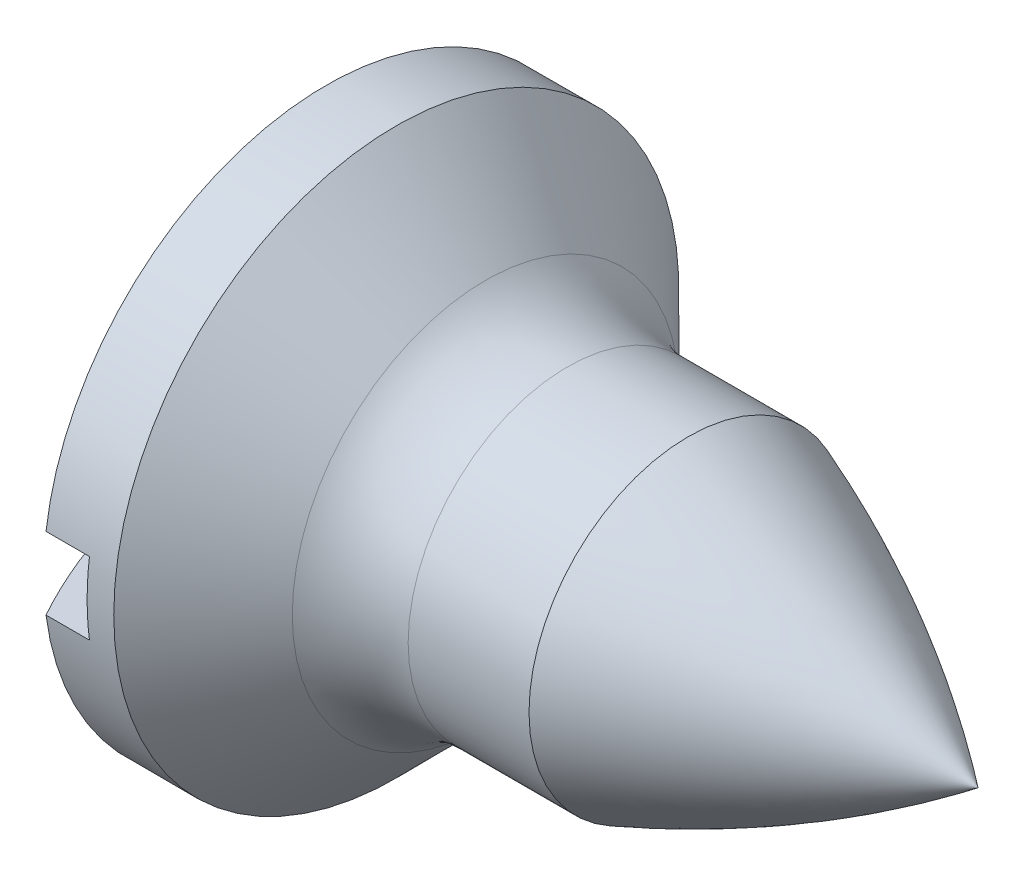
SolidWorks part; units mm, degrees
ref_plane "Front" through (0, 0, 0) normal (0, 0, 1) x (1, 0, 0)
ref_plane "Top" through (0, 0, 0) normal (0, 1, 0) x (1, 0, 0)
ref_plane "Right" through (0, 0, 0) normal (1, 0, 0) x (0, 0, -1)
sketch "Sketch1" plane through (0, 0, 0) normal (0, 0, 1) x (1, 0, 0)
  line L0 (-40.1945, 0) -> (11.3165, 0) construction
  line L1 (5.0078, 1.1) -> (5.0078, 0)
  line L2 (5.0078, 1.1) -> (2.1735, 1.1)
  line L3 (1.6078, 1.3343) -> (0.9916, 1.9506)
  line L4 (0.9916, 1.9506) -> (0.5078, 1.9506)
  line L5 (5.0078, 0) -> (0, 0)
  line L6 (2.4078, 2.2911) -> (2.4078, -1.7726) construction
  arc A0 (0.5078, 1.9506) -> (0, 0) centre (4, 0) ccw
  arc A1 (2.1735, 1.1) -> (1.6078, 1.3343) centre (2.1735, 1.9) cw
  point P12 (0.0078, 0.25)
  dimension "D2" = 45
  dimension "R1" = 4
  dimension "r" = 0.8
  dimension "st" = 2.2
  dimension "k" = 1.1
  dimension "l" = 4.5
  dimension "f" = 0.5
  dimension "n" = 0.5
  dimension "a" = 0.8
revolve "Base" add sketch "Sketch1" angle 360 about L0
sketch "Sketch2" plane through (0, 0, 0) normal (0, 0, 1) x (1, 0, 0)
  line L1 (0.0078, 0.25) -> (0.8078, 0.25)
  line L3 (0.0078, -0.25) -> (0.8078, -0.25)
  line L4 (0.8078, 0.25) -> (0.8078, -0.25)
  line L5 (0.5078, 1.9506) -> (0.5078, -1.9506) construction
  line L6 (1.1738, 0) -> (-4.2219, 0) construction
  arc A0 (0.5078, 1.9506) -> (0.5078, -1.9506) centre (4, 0) ccw construction
  arc A1 (0.0078, 0.25) -> (0.0078, -0.25) centre (0.5078, 0) ccw
  dimension "n" = 0.5
  dimension "t" = 0.8
extrude "Slot" cut sketch "Sketch2" against normal through all and the other way through all
sketch "Sketch3" plane through (0, 0, 0) normal (0, 0, 1) x (1, 0, 0)
  line L0 (1.3282, 0) -> (-8.063, 0) construction
  line L1 (2.1735, -1.1) -> (5.0078, -1.1) construction
  line L2 (3.4078, -1.1) -> (4.2078, -1.1)
  line L3 (4.2078, -1.1) -> (5.0078, -0.9)
  line L6 (3.4078, -1.1) -> (3.4078, -1.6)
  line L7 (3.4078, -1.6) -> (5.0078, -1.6)
  line L8 (5.0078, -1.6) -> (5.0078, -0.9)
  line L9 (5.0078, -1.1) -> (5.0078, 1.1) construction
  point P15 (4.2078, -1.1)
  dimension "yf" = 1.6
  dimension "D2" = 0.8
  dimension "D3" = 0.2
  dimension "D4" = 0.5
revolve "Cut-Revolve1" [suppressed] cut sketch "Sketch3" angle 360 about L0
sketch "Sketch4" plane through (0, 0, 0) normal (0, 0, 1) x (1, 0, 0)
  line L0 (35.861, 0) -> (12.5324, 0) construction
  line L2 (5.0078, -1.1) -> (5.0078, 1.1) construction
  line L3 (5.0078, 0) -> (3.0078, -1.1) construction
  line L6 (5.0078, 0) -> (5.5078, 0)
  line L7 (3.0078, -1.1) -> (5.0078, -1.1)
  line L8 (5.5078, 0) -> (5.5078, -1.1)
  line L9 (5.5078, -1.1) -> (5.0078, -1.1)
  arc A0 (5.0078, 0) -> (3.0078, -1.1) centre (0.1919, 6.388) cw
  dimension "D1" = 8
  dimension "D2" = 0.5
  dimension "yc" = 2
  dimension "D3" = 2.2
revolve "Cut-Revolve6" cut sketch "Sketch4" angle 360 about L0
sketch "Sketch5" plane through (0, 0, 0) normal (0, 0, 1) x (1, 0, 0)
  line L0 (2.1578, 1.6) -> (2.6578, 1.6)
  line L1 (2.6578, 1.6) -> (2.6578, 1.1)
  line L2 (2.6578, 1.1) -> (2.4078, 0.667)
  line L3 (2.4078, 0.667) -> (2.1578, 1.1)
  line L4 (2.1578, 1.1) -> (2.1578, 1.6)
  line L5 (0, 0) -> (0.2368, 0) construction
  dimension "D1" = 2.2
  dimension "D2" = 0.8
  dimension "D3" = 0.5
revolve "Cut-Revolve10" [suppressed] cut sketch "Sketch5" angle 360 about L5
pattern_linear "LPattern10" [suppressed] count 4 spacing 0.6 along (1, 0, 0)
equation "\"D3@Sketch3\" = \"yf@Sketch3\" / 8"
equation "\"D2@ThreadCosmetic1\" = \"st@Sketch1\" - 1"
equation "\"D1@Sketch4\" = \"yc@Sketch4\" * 4"
equation "\"D3@Sketch4\" = \"st@Sketch1\""
equation "\"D2@Sketch3\" = \"yf@Sketch3\" / 2"
equation "\"D1@ThreadCosmetic1\" = \"l@Sketch1\" - \"k@Sketch1\" - \"a@Sketch1\""
equation "\"D1@Sketch5\" = \"st@Sketch1\""
equation "\"D2@Sketch5\" = \"a@Sketch1\""
equation "\"D3@Sketch5\" =  ( \"st@Sketch1\" - \"D2@ThreadCosmetic1\" )  / 2"
equation "\"D3@LPattern10\" = \"D3@Sketch5\" * 1.2"
equation "\"D1@LPattern10\" = \"D1@ThreadCosmetic1\" / \"D3@LPattern10\""
